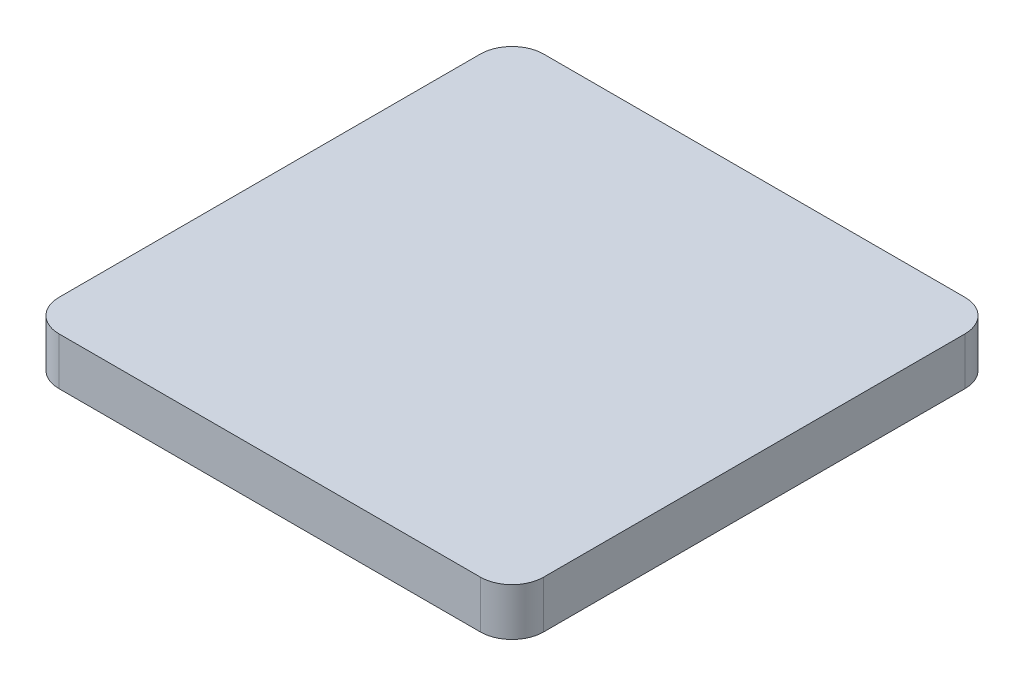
SolidWorks part; units mm, degrees
ref_plane "前视基准面" through (0, 0, 0) normal (0, 0, 1) x (1, 0, 0)
ref_plane "上视基准面" through (0, 0, 0) normal (0, 1, 0) x (1, 0, 0)
ref_plane "右视基准面" through (0, 0, 0) normal (1, 0, 0) x (0, 0, -1)
sketch "草图1" plane through (0, 0, 0) normal (0, 1, 0) x (1, 0, 0)
  line L1 (-7.65, 7.65) -> (7.65, 7.65)
  line L2 (-7.65, 7.65) -> (-7.65, -7.65)
  line L3 (-7.65, -7.65) -> (7.65, -7.65)
  line L4 (7.65, 7.65) -> (7.65, -7.65)
  line L5 (-7.65, 7.65) -> (7.65, -7.65) construction
  line L6 (-7.65, -7.65) -> (7.65, 7.65) construction
  point P0 (0, 0)
  dimension "D1" = 15.3
  dimension "D2" = 15.3
extrude "凸台-拉伸1" add sketch "草图1" along normal blind 1.5
fillet "圆角1" radius 1 4 edges at (-7.65, 0.75, -7.65) (7.65, 0.75, -7.65) (7.65, 0.75, 7.65) (-7.65, 0.75, 7.65)
